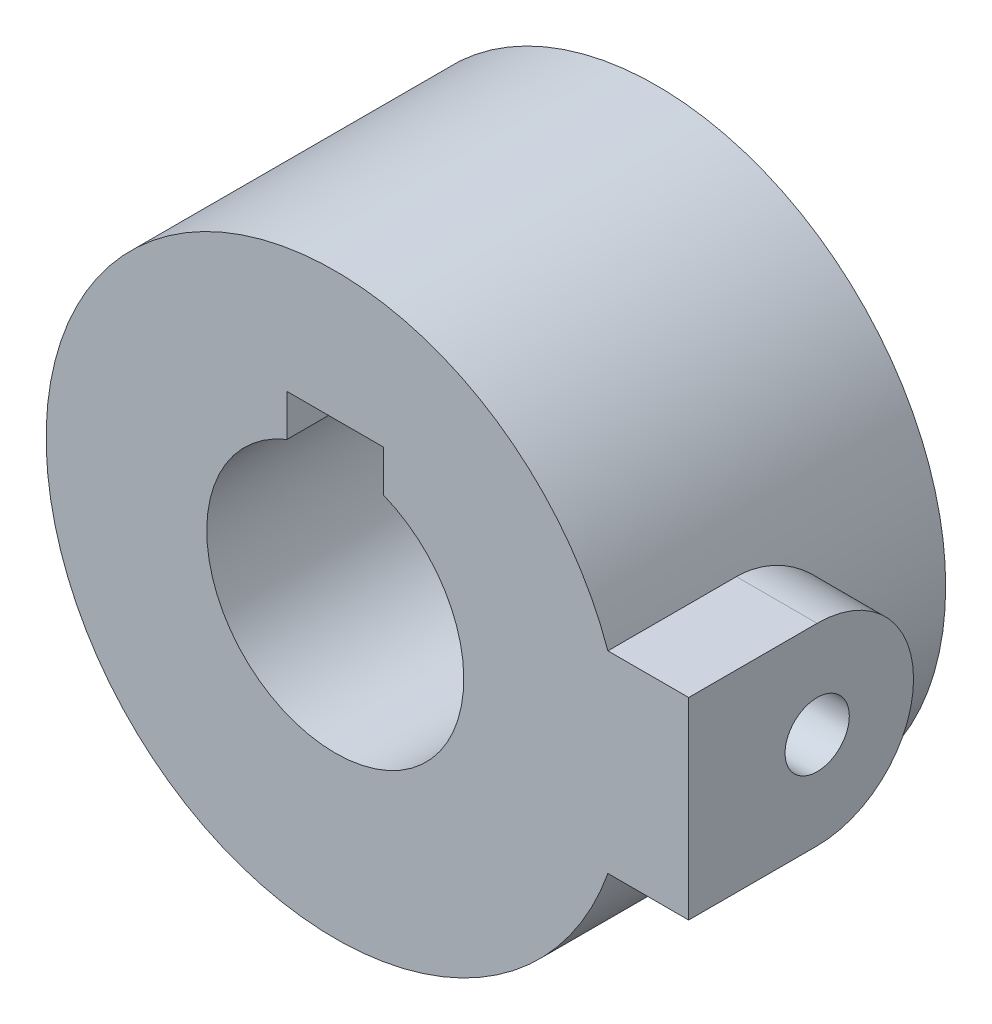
SolidWorks part; units mm, degrees
ref_plane "前视基准面" through (0, 0, 0) normal (0, 0, 1) x (1, 0, 0)
ref_plane "上视基准面" through (0, 0, 0) normal (0, 1, 0) x (1, 0, 0)
ref_plane "右视基准面" through (0, 0, 0) normal (1, 0, 0) x (0, 0, -1)
sketch "草图1" plane through (0, 0, 0) normal (0, 0, 1) x (1, 0, 0)
  line L0 (0, 11.715) -> (0, -12.6704) construction
  line L1 (-12.634, 0) -> (12.1078, 0) construction
  line L2 (-3, 7.4162) -> (-3, 10)
  line L3 (-3, 10) -> (3, 10)
  line L4 (3, 7.4162) -> (3, 10)
  arc A0 (-3, 7.4162) -> (3, 7.4162) centre (0, 0) ccw
  circle A1 centre (0, 0) radius 18
  point P13 (0, 10)
  dimension "D1" = 36
  dimension "D2" = 16
  dimension "D4" = 10
  dimension "D3" = 6
extrude "凸台-拉伸1" add sketch "草图1" along normal blind 20
ref_plane "基准面1" through (22, 0, 0) normal (1, 0, 0) x (0, 0, -1)
sketch "草图2" plane through (22, 0, 0) normal (1, 0, 0) x (0, 0, -1)
  line L0 (-24.8754, 0) -> (-6.9723, 0) construction
  line L1 (-12, 6.7466) -> (-12, -9.8402) construction
  line L2 (-20, 18) -> (-20, -18) construction
  line L3 (-12, 6) -> (-20, 6)
  line L4 (-12, -6) -> (-20, -6)
  line L5 (-20, 6) -> (-20, -6)
  circle A0 centre (-12, 0) radius 2
  arc A1 (-12, -6) -> (-12, 6) centre (-12, 0) ccw
  dimension "D1" = 6
  dimension "D2" = 4
  dimension "D3" = 8
extrude "凸台-拉伸2" add sketch "草图2" against normal up to next
sketch "草图3" plane through (0, 0, 0) normal (0, 0, 1) x (1, 0, 0)
  line L0 (-34.0887, -11.0434) -> (-44.7846, -29.5692)
  line L1 (-30.886, -25.4962) -> (-36.1244, -34.5692)
  line L2 (-64.6804, -18.0824) -> (-14.5619, -47.0183) construction
  line L3 (0, 0) -> (-29.2961, -50.7424) construction
  line L4 (0, 0) -> (-50.4077, 29.1029) construction
  line L5 (-44.7846, -29.5692) -> (-36.1244, -34.5692)
  line L6 (0, 27.6676) -> (0, -63.6812) construction
  arc A0 (-10.2174, 14.8191) -> (-6.4258, -16.814) centre (0, 0) ccw
  arc A1 (-6.4258, -16.814) -> (-30.886, -25.4962) centre (-13.5655, -35.4962) ccw
  arc A2 (-10.2174, 14.8191) -> (-34.0887, -11.0434) centre (35.1933, -51.0434) ccw
  dimension "D4" = 20
  dimension "D5" = 36
  dimension "D6" = 80
  dimension "D1" = 48
  dimension "D2" = 24
  dimension "D3" = 10
  dimension "D7" = 30
